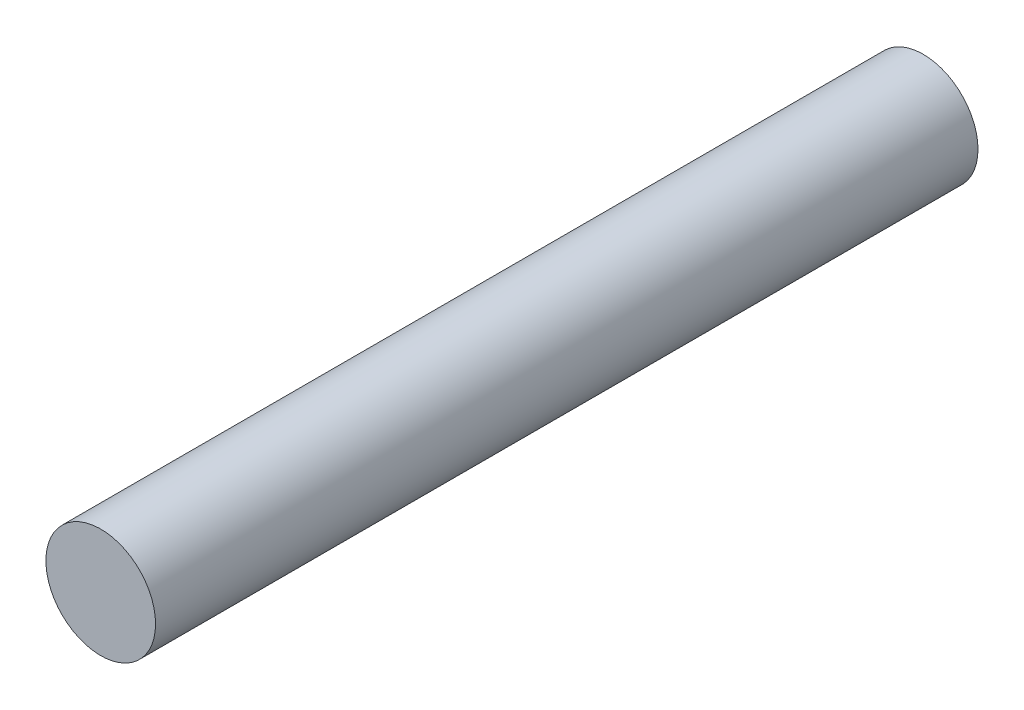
SolidWorks part; units mm, degrees
ref_plane "Front Plane" through (0, 0, 0) normal (0, 0, 1) x (1, 0, 0)
ref_plane "Top Plane" through (0, 0, 0) normal (0, 1, 0) x (1, 0, 0)
ref_plane "Right Plane" through (0, 0, 0) normal (1, 0, 0) x (0, 0, -1)
sketch "Sketch1" plane through (0, 0, 0) normal (0, 0, 1) x (1, 0, 0)
  circle A0 centre (0, 0) radius 4
  dimension "D1" = 8
extrude "Boss-Extrude1" add sketch "Sketch1" along normal mid plane 60
